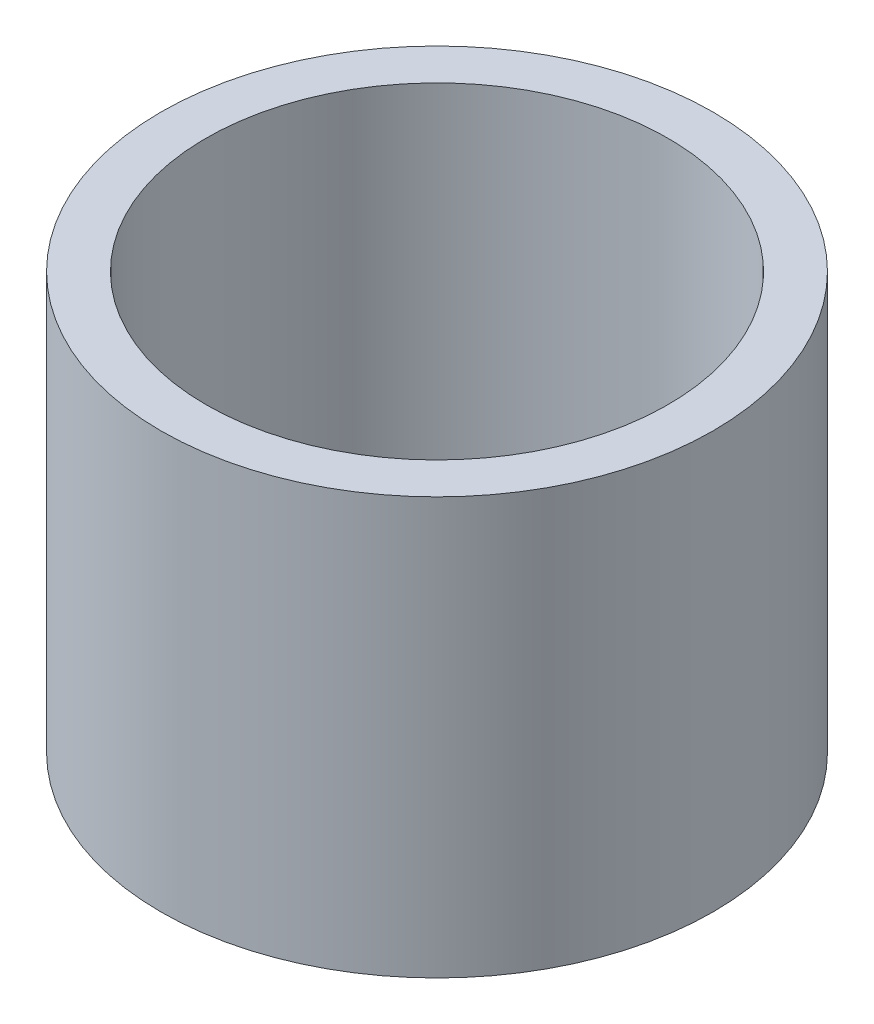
SolidWorks part; units mm, degrees
ref_plane "Front" through (0, 0, 0) normal (0, 0, 1) x (1, 0, 0)
ref_plane "Top" through (0, 0, 0) normal (0, 1, 0) x (1, 0, 0)
ref_plane "Right" through (0, 0, 0) normal (1, 0, 0) x (0, 0, -1)
sketch "Sketch1" plane through (0, 0, 0) normal (0, 1, 0) x (1, 0, 0)
  circle A0 centre (0, 0) radius 46
  circle A1 centre (0, 0) radius 55
  dimension "D1" = 92
  dimension "D2" = 110
extrude "Extrude1" add sketch "Sketch1" along normal blind 83
